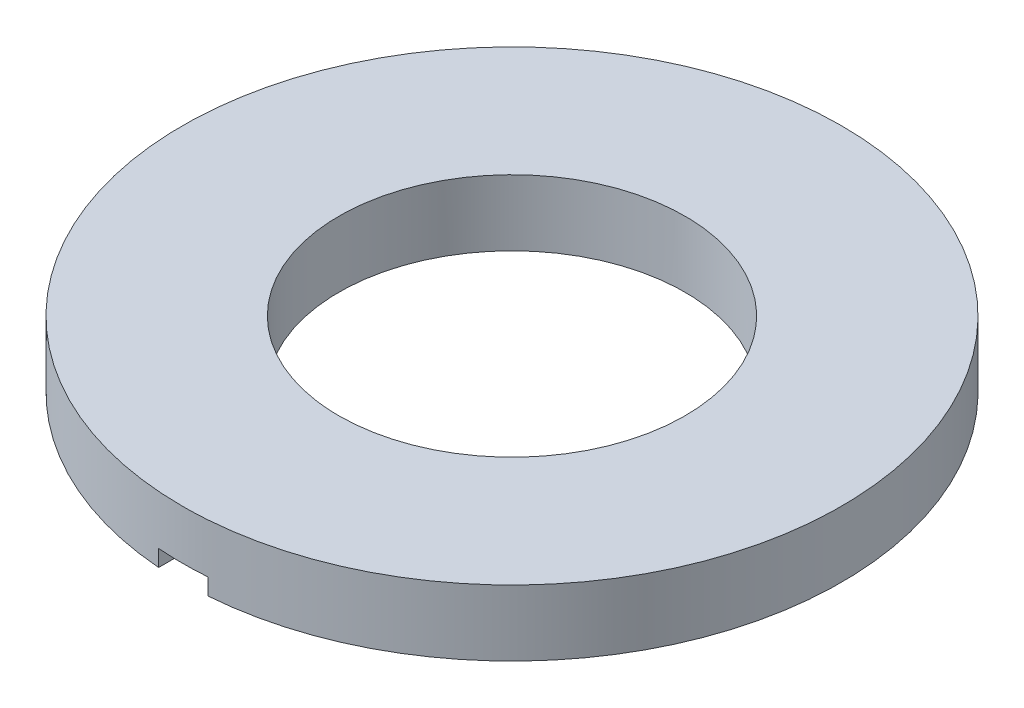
SolidWorks part; units mm, degrees
ref_plane "Front Plane" through (0, 0, 0) normal (0, 0, 1) x (1, 0, 0)
ref_plane "Top Plane" through (0, 0, 0) normal (0, 1, 0) x (1, 0, 0)
ref_plane "Right Plane" through (0, 0, 0) normal (1, 0, 0) x (0, 0, -1)
sketch "Sketch1" plane through (0, 0, 0) normal (0, 1, 0) x (1, 0, 0)
  circle A0 centre (0, 0) radius 4.2
  circle A1 centre (0, 0) radius 8
  dimension "D1" = 8.4
  dimension "D2" = 16
extrude "Extrude1" add sketch "Sketch1" along normal blind 1.6
sketch "Sketch2" plane through (0, 0, 0) normal (0, -1, 0) x (1, 0, 0)
  line L1 (-0.6, 0.4) -> (0.6, 0.4)
  line L2 (-0.6, 0.4) -> (-0.6, 8)
  line L3 (-0.6, 8) -> (0.6, 8)
  line L4 (0.6, 0.4) -> (0.6, 8)
  line L5 (-0.6, 0.4) -> (0.6, 8) construction
  line L6 (-0.6, 8) -> (0.6, 0.4) construction
  circle A0 centre (0, 0) radius 4.2 construction
  circle A1 centre (0, 0) radius 8 construction
  point P0 (0, 4.2)
  dimension "D1" = 1.2
extrude "Cut-Extrude1" cut sketch "Sketch2" against normal blind 0.4
